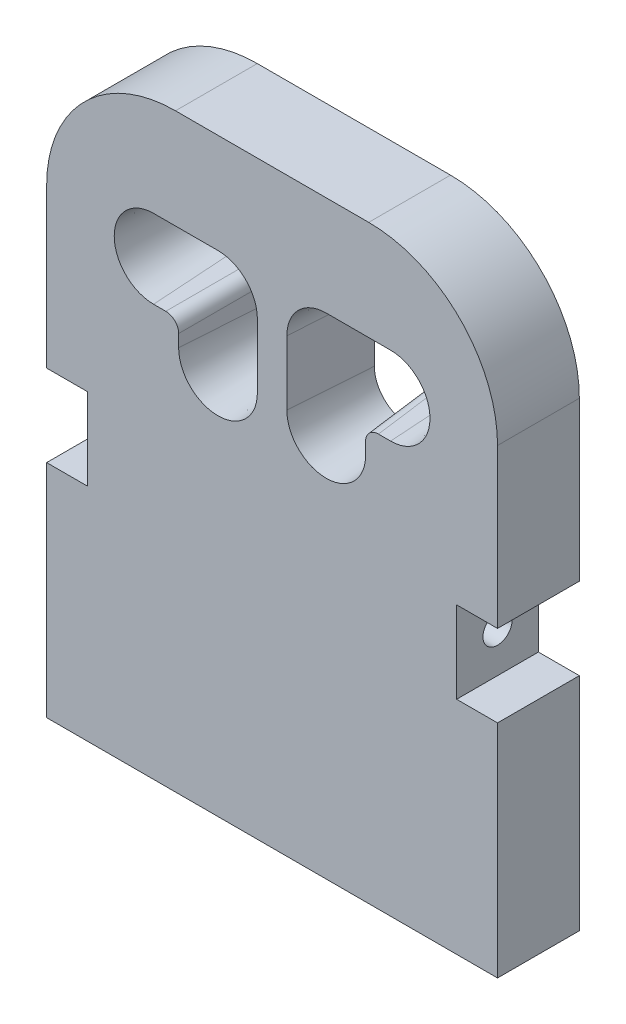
SolidWorks part; units mm, degrees
ref_plane "Front Plane" through (0, 0, 0) normal (0, 0, 1) x (1, 0, 0)
ref_plane "Top Plane" through (0, 0, 0) normal (0, 1, 0) x (1, 0, 0)
ref_plane "Right Plane" through (0, 0, 0) normal (1, 0, 0) x (0, 0, -1)
sketch "Sketch1" plane through (0, 0, 0) normal (0, 0, 1) x (1, 0, 0)
  line L1 (17.5, -22.9) -> (-17.5, -22.9)
  line L2 (17.5, -22.9) -> (17.5, 22.9)
  line L3 (17.5, 22.9) -> (-17.5, 22.9)
  line L4 (-17.5, -22.9) -> (-17.5, 22.9)
  line L5 (17.5, -22.9) -> (-17.5, 22.9) construction
  line L6 (17.5, 22.9) -> (-17.5, -22.9) construction
  point P0 (0, 0)
  dimension "D1" = 35
  dimension "D2" = 45.8
extrude "Boss-Extrude1" add sketch "Sketch1" along normal blind 6.35
sketch "Sketch2" plane through (0, 0, 6.35) normal (0, 0, 1) x (1, 0, 0)
  line L2 (-9.6, 14.6) -> (-4.6, 14.6) construction
  line L3 (-9.6, 17.1) -> (-4.6, 17.1)
  line L4 (-9.6, 12.1) -> (-4.6, 12.1)
  line L5 (0, 0) -> (0, 50000) construction
  line L6 (9.6, 14.6) -> (4.6, 14.6) construction
  line L7 (9.6, 17.1) -> (4.6, 17.1)
  line L8 (9.6, 12.1) -> (4.6, 12.1)
  line L9 (-17.5, -22.9) -> (17.5, -22.9) construction
  arc A0 (-9.6, 17.1) -> (-9.6, 12.1) centre (-9.6, 14.6) ccw
  arc A1 (-4.6, 12.1) -> (-4.6, 17.1) centre (-4.6, 14.6) ccw
  circle A2 centre (0, 14.6) radius 2.1 construction
  arc A3 (9.6, 17.1) -> (9.6, 12.1) centre (9.6, 14.6) cw
  arc A4 (4.6, 12.1) -> (4.6, 17.1) centre (4.6, 14.6) cw
  point P2 (-7.1, 14.6)
  point P13 (7.1, 14.6)
  dimension "D1" = 2.5
  dimension "D2" = 5
  dimension "D3" = 4.2
  dimension "D4" = 37.5
extrude "Cut-Extrude2" [suppressed] cut sketch "Sketch2" against normal up to next
sketch "Sketch3" plane through (0, 0, 6.35) normal (0, 0, 1) x (1, 0, 0)
  line L0 (-5, 9.6) -> (-5, 14.6) construction
  line L1 (-7.5, 9.6) -> (-7.5, 14.6)
  line L2 (-2.5, 9.6) -> (-2.5, 14.6)
  line L3 (0, 0) -> (0, 50000) construction
  line L4 (-17.5, -22.9) -> (17.5, -22.9) construction
  line L5 (5, 9.6) -> (5, 14.6) construction
  line L6 (7.5, 9.6) -> (7.5, 14.6)
  line L7 (2.5, 9.6) -> (2.5, 14.6)
  arc A0 (-7.5, 9.6) -> (-2.5, 9.6) centre (-5, 9.6) ccw
  arc A1 (-2.5, 14.6) -> (-7.5, 14.6) centre (-5, 14.6) ccw
  arc A2 (7.5, 9.6) -> (2.5, 9.6) centre (5, 9.6) cw
  arc A3 (2.5, 14.6) -> (7.5, 14.6) centre (5, 14.6) cw
  point P2 (-5, 12.1)
  point P14 (5, 12.1)
  dimension "D1" = 2.5
  dimension "D2" = 5
  dimension "D3" = 37.5
  dimension "D4" = 5
extrude "Cut-Extrude3" [suppressed] cut sketch "Sketch3" against normal up to next
fillet "Fillet1" [suppressed] radius 0.5
fillet "Fillet3" radius 10 2 edges at (17.5, 22.9, 3.175) (-17.5, 22.9, 3.175)
sketch "Sketch10" plane through (-17.5, 0, 0) normal (-1, 0, 0) x (0, 0, 1)
  line L0 (6.35, 12.9) -> (6.35, -22.9) construction
  line L1 (6.35, 0.6) -> (0, 0.6)
  line L2 (6.35, 0.6) -> (6.35, -5.75)
  line L3 (6.35, -5.75) -> (0, -5.75)
  line L4 (0, 0.6) -> (0, -5.75)
  line L6 (6.35, -22.9) -> (0, -22.9) construction
  dimension "D1" = 6.35
  dimension "D2" = 23.5
extrude "Cut-Extrude5" cut sketch "Sketch10" against normal blind 3.175
sketch "Sketch11" plane through (17.5, 0, 0) normal (1, 0, 0) x (0, 0, -1)
  line L0 (-6.35, -22.9) -> (-6.35, 12.9) construction
  line L1 (-6.35, 0.6) -> (0, 0.6)
  line L2 (-6.35, 0.6) -> (-6.35, -5.75)
  line L3 (-6.35, -5.75) -> (0, -5.75)
  line L4 (0, 0.6) -> (0, -5.75)
  line L5 (0, -22.9) -> (0, 12.9) construction
  line L6 (-6.35, -22.9) -> (0, -22.9) construction
  dimension "D1" = 6.35
  dimension "D2" = 23.5
extrude "Cut-Extrude6" cut sketch "Sketch11" against normal blind 3.175
sketch "Sketch12" plane through (-14.325, 0, 0) normal (-1, 0, 0) x (0, 0, 1)
  line L3 (6.35, 0.6) -> (0, 0.6) construction
  line L4 (6.35, -5.75) -> (6.35, 0.6) construction
  circle A0 centre (3.175, -2.575) radius 1.5875
  dimension "D3" = 3.175
  dimension "D1" = 3.175
  dimension "D2" = 3.175
hole_wizard "Tap Drill for #4-40 Tap2" positions "Sketch14" profile "Sketch15" hole size "#4-40" standard "ANSI Inch"
sketch "Sketch14" plane through (-14.325, 0, 0) normal (-1, 0, 0) x (0, 0, 1)
  point P0 (3.175, -2.575)
sketch "Sketch15" plane through (-14.325, -2.575, 3.175) normal (0, 1, 0) x (0, 0, 1)
  line L0 (0, 0) -> (0, 7.0292)
  line L1 (0, 7.0292) -> (1.1303, 6.35)
  line L2 (1.1303, 6.35) -> (1.1303, 0)
  line L5 (1.1303, 0) -> (0, 0)
  line L10 (0, 7.0292) -> (-1.1303, 6.35) construction
  line L11 (0, -6.35) -> (0, 107.95) construction
  dimension "Hole Dia." = 2.2606
  dimension "Hole Depth" = 6.35
  dimension "Drill Angle" = 118
ref_plane "Mid Plane" through (0, 0, 0) normal (1, 0, 0) x (0, 0, -1)
mirror "Mirror1" about plane through (0, 0, 0) normal (1, 0, 0) of "Tap Drill for #4-40 Tap2"
sketch "Sketch16" plane through (0, -22.9, 0) normal (0, -1, 0) x (1, 0, 0)
  line L0 (-11.5, 3.175) -> (-5.5, 3.175)
  line L1 (-17.5, 6.35) -> (-17.5, 0) construction
  line L2 (-17.5, 0) -> (17.5, 0) construction
  point P2 (-17.5, 3.175)
  dimension "D1" = 6
  dimension "D2" = 6
  dimension "D3" = 3.175
hole_wizard "1/8 (0.1250) Dowel Hole1" positions "Sketch18" profile "Sketch17" hole size "1/8" standard "ANSI Inch"
sketch "Sketch18" plane through (0, -22.9, 0) normal (0, -1, 0) x (-1, 0, 0)
  point P0 (5.5, -3.175)
sketch "Sketch17" plane through (-5.5, -22.9, 3.175) normal (1, 0, 0) x (0, 0, -1)
  line L0 (0, 0) -> (0, 7.3039)
  line L1 (0, 7.3039) -> (1.5875, 6.35)
  line L2 (1.5875, 6.35) -> (1.5875, 0)
  line L5 (1.5875, 0) -> (0, 0)
  line L10 (0, 7.3039) -> (-1.5875, 6.35) construction
  line L11 (0, -6.35) -> (0, 107.95) construction
  dimension "Hole Dia." = 3.175
  dimension "Hole Depth" = 6.35
  dimension "Drill Angle" = 118
hole_wizard "Tap Drill for #4-40 Tap1" positions "Sketch20" profile "Sketch19" hole size "#4-40" standard "ANSI Inch"
sketch "Sketch20" plane through (0, -22.9, 0) normal (0, -1, 0) x (-1, 0, 0)
  point P0 (11.5, -3.175)
sketch "Sketch19" plane through (-11.5, -22.9, 3.175) normal (1, 0, 0) x (0, 0, -1)
  line L0 (0, 0) -> (0, 13.3792)
  line L1 (0, 13.3792) -> (1.1303, 12.7)
  line L2 (1.1303, 12.7) -> (1.1303, 0)
  line L5 (1.1303, 0) -> (0, 0)
  line L10 (0, 13.3792) -> (-1.1303, 12.7) construction
  line L11 (0, -6.35) -> (0, 107.95) construction
  dimension "Hole Dia." = 2.2606
  dimension "Hole Depth" = 12.7
  dimension "Drill Angle" = 118
mirror "Mirror2" about plane through (0, 0, 0) normal (1, 0, 0) of "Tap Drill for #4-40 Tap1"
mirror "Mirror3" about plane through (0, 0, 0) normal (1, 0, 0) of "1/8 (0.1250) Dowel Hole1"
sketch "Sketch21" plane through (0, 0, 0) normal (0, 0, -1) x (-1, 0, 0)
  line L0 (4.2, 12.1) -> (9.2, 12.1) construction
  line L1 (4.2, 14.711) -> (9.2, 14.711)
  line L2 (4.2, 9.489) -> (9.2, 9.489)
  line L3 (4.2, 7.1) -> (4.2, 12.1) construction
  line L4 (1.589, 7.1) -> (1.589, 12.1)
  line L5 (6.811, 7.1) -> (6.811, 12.1)
  line L7 (17.5, -22.9) -> (-17.5, -22.9) construction
  arc A0 (4.2, 14.711) -> (4.2, 9.489) centre (4.2, 12.1) ccw
  arc A1 (9.2, 9.489) -> (9.2, 14.711) centre (9.2, 12.1) ccw
  arc A2 (1.589, 7.1) -> (6.811, 7.1) centre (4.2, 7.1) ccw
  arc A3 (6.811, 12.1) -> (1.589, 12.1) centre (4.2, 12.1) ccw
  point P2 (6.7, 12.1)
  point P10 (4.2, 9.6)
  dimension "D5" = 2.611
  dimension "D3" = 2.611
  dimension "D2" = 35
  dimension "D4" = 5
  dimension "D6" = 5
extrude "Cut-Extrude7" cut sketch "Sketch21" against normal through all draft 4 contours L5 A3 L4 A0 L1 | A0 A2 L5 L1 | A2 L2 A1 L1 L5
fillet "Fillet5" radius 1 1 edges at (-7.033, 9.267, 3.175)
mirror "Mirror5" about plane through (0, 0, 0) normal (1, 0, 0) of "Fillet5", "Cut-Extrude7"
sketch "Sketch27" plane through (0, 0, 6.35) normal (0, 0, 1) x (1, 0, 0)
  point P0 (0, 2.1)
sketch "Sketch28" plane through (0, 0, 0) normal (0, 0, -1) x (-1, 0, 0)
  arc A0 (-9.2, 14.711) -> (-9.2, 9.489) centre (-9.2, 12.1) ccw construction
  point P0 (0, 2.1)
  dimension "D1" = 10
hole_wizard "Tap Drill for #4-40 Tap3" positions "Sketch30" profile "Sketch29" hole size "#4-40" standard "ANSI Inch"
sketch "Sketch30" plane through (0, 0, 0) normal (0, 0, -1) x (-1, 0, 0)
  point P0 (0, 2.1)
sketch "Sketch29" plane through (0, 2.1, 0) normal (1, 0, 0) x (0, 1, 0)
  line L0 (0, 0) -> (0, 4.648)
  line L1 (0, 4.648) -> (1.1303, 3.9688)
  line L2 (1.1303, 3.9688) -> (1.1303, 0)
  line L5 (1.1303, 0) -> (0, 0)
  line L10 (0, 4.648) -> (-1.1303, 3.9688) construction
  line L11 (0, -6.35) -> (0, 107.95) construction
  dimension "Hole Dia." = 2.2606
  dimension "Hole Depth" = 3.9688
  dimension "Drill Angle" = 118
